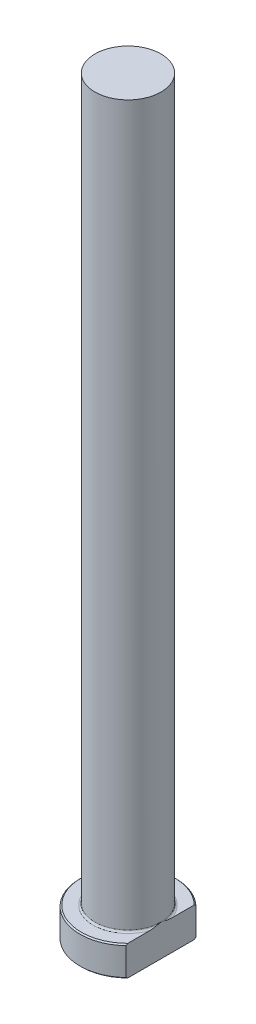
SolidWorks part; units mm, degrees
ref_plane "Front Plane" through (0, 0, 0) normal (0, 0, 1) x (1, 0, 0)
ref_plane "Top Plane" through (0, 0, 0) normal (0, 1, 0) x (1, 0, 0)
ref_plane "Right Plane" through (0, 0, 0) normal (1, 0, 0) x (0, 0, -1)
sketch "Sketch1" plane through (0, 0, 0) normal (0, 0, 1) x (1, 0, 0)
  line L0 (0, 259.9588) -> (0, -15.1925) construction
  line L1 (0, 0) -> (-8, 0)
  line L2 (-8, 0) -> (-8, 5)
  line L3 (-8, 5) -> (-5.5, 5)
  line L4 (-5.5, 5) -> (-5.5, 125)
  line L5 (-5.5, 125) -> (0, 125)
  line L6 (0, 125) -> (0, 0)
  dimension "L" = 125
  dimension "H" = 16
  dimension "T" = 5
  dimension "D" = 11
revolve "Revolve1" add sketch "Sketch1" angle 360 about L0
chamfer "Chamfer1" distance 0.2 angle 45 2 edges at (0, 5, 8) (0, 0, 8)
fillet "Fillet1" radius 0.3 1 edges at (0, 5, 5.5)
sketch "Sketch2" plane through (0, 0, 0) normal (0, 1, 0) x (1, 0, 0)
  line L0 (5.5, 5.8095) -> (5.5, -5.8095)
  circle A0 centre (0, 0) radius 8 construction
  arc A1 (5.5, -5.8095) -> (5.5, 5.8095) centre (0, 0) ccw
  circle A2 centre (0, 0) radius 5.5 construction
extrude "KEY" cut sketch "Sketch2" along normal through all
